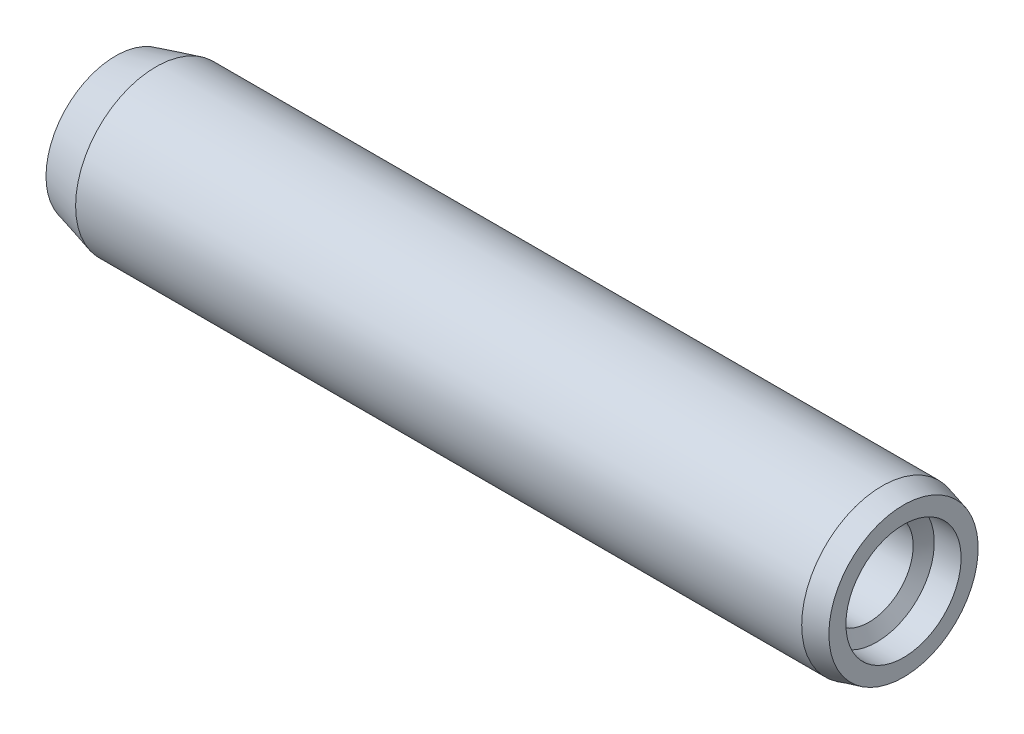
SolidWorks part; units mm, degrees
ref_plane "Plane1" through (0, 0, 0) normal (0, 0, 1) x (1, 0, 0)
ref_plane "Plane2" through (0, 0, 0) normal (0, 1, 0) x (1, 0, 0)
ref_plane "Plane3" through (0, 0, 0) normal (1, 0, 0) x (0, 0, -1)
sketch "Sketch1" plane through (0, 0, 0) normal (0, 0, 1) x (1, 0, 0)
  line L0 (-10, 0) -> (106, 0) construction
  line L1 (0, 0) -> (0, 2.4373)
  line L2 (2.1, 3) -> (29.2, 3)
  line L3 (30, 2.7856) -> (30, 2.15)
  line L4 (19.0086, 0) -> (0, 0)
  line L5 (2.1, 3) -> (0, 2.4373)
  line L6 (30, 2.7856) -> (29.2, 3)
  line L7 (19.0086, 0) -> (20, 1.65)
  line L8 (20, 1.65) -> (28.7113, 1.65)
  line L9 (28.7113, 1.65) -> (29, 2.15)
  line L10 (28.7113, -1.65) -> (29, -2.15) construction
  line L11 (29, 2.15) -> (30, 2.15)
  line L12 (19.0086, 0) -> (20, -1.65) construction
  dimension "D1" = 15
  dimension "Length" = 30
  dimension "D2" = 75
  dimension "ChamferLengthA" = 0.8
  dimension "D3" = 120
  dimension "Diameter" = 6
  dimension "CboreDia" = 4.3
  dimension "D4" = 118
  dimension "CboreDepth" = 1
  dimension "TapDrillDepth" = 10
  dimension "TapDrillDia" = 3.3
  dimension "ChamferLengthC" = 2.1
revolve "Base-Revolve" add sketch "Sketch1" angle 360 about L0
sketch "Sketch2" plane through (0, 0, 0) normal (0, 0, 1) x (1, 0, 0)
  line L0 (0, 0) -> (26, 0) construction
  line L1 (-10, 0) -> (106, 0) construction
  line L2 (0, 2.4373) -> (0, -2.4373) construction
  line L3 (0.5904, 2.5955) -> (0.5904, 8)
  line L5 (0.5904, 8) -> (-5, 8)
  line L6 (-5, 8) -> (-5, 0)
  line L7 (-5, 0) -> (0, 0)
  line L8 (2.1, 3) -> (0, 2.4373) construction
  line L9 (29.2, 3) -> (2.1, 3) construction
  arc A0 (0.5904, 2.5955) -> (0, 0) centre (6, 0) ccw
  dimension "D1" = 6
  dimension "D2" = 5
  dimension "D3" = 5
revolve "TypeA" cut sketch "Sketch2" angle 360 about L0
equation "\"D1@Sketch2\" = \"Diameter@Sketch1\""
